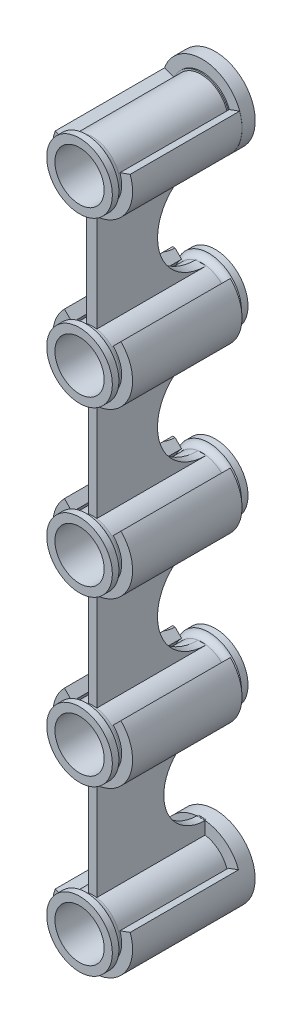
SolidWorks part; units mm, degrees
ref_plane "Front Plane" through (0, 0, 0) normal (0, 0, 1) x (1, 0, 0)
ref_plane "Top Plane" through (0, 0, 0) normal (0, 1, 0) x (1, 0, 0)
ref_plane "Right Plane" through (0, 0, 0) normal (1, 0, 0) x (0, 0, -1)
sketch "Sketch1" plane through (0, 0, 0) normal (0, 0, 1) x (1, 0, 0)
  line L0 (0, 0) -> (0, 4.0671) construction
  line L1 (0, 0) -> (3.5034, 0) construction
  line L2 (0, 0) -> (0, -3.7032) construction
  line L3 (0, 0) -> (-3.861, 0) construction
  line L4 (0, 0) -> (-7.4082, -2.6964) construction
  line L5 (0, 0) -> (7.4082, -2.6964) construction
  line L7 (0.75, 4.4408) -> (-0.75, 4.4408)
  line L8 (0.75, 4.4408) -> (0.75, 23.3282)
  line L9 (0.75, 23.3282) -> (-0.75, 23.3282)
  line L10 (-0.75, 4.4408) -> (-0.75, 23.3282)
  line L11 (0.75, 34.3376) -> (-0.75, 34.3376)
  line L12 (0.75, 34.3376) -> (0.75, 53.6844)
  line L13 (0.75, 53.6844) -> (-0.75, 53.6844)
  line L14 (-0.75, 34.3376) -> (-0.75, 53.6844)
  line L15 (0.75, 64.2553) -> (-0.75, 64.2553)
  line L16 (0.75, 64.2553) -> (0.75, 83.5232)
  line L17 (0.75, 83.5232) -> (-0.75, 83.5232)
  line L18 (-0.75, 64.2553) -> (-0.75, 83.5232)
  line L19 (0.75, 93.8385) -> (-1.171, 93.8385)
  line L20 (0.75, 93.8385) -> (0.75, 113.6965)
  line L21 (0.75, 113.6965) -> (-1.171, 113.6965)
  line L22 (-1.171, 93.8385) -> (-1.171, 113.6965)
  line L31 (0, 0) -> (4.6985, 1.7101)
  line L32 (0, 0) -> (-4.6985, 1.7101)
  line L33 (-4.9804, 1.8127) -> (-6.8598, 2.4967)
  line L34 (4.9804, 1.8127) -> (6.8598, 2.4967)
  line L35 (0, 30) -> (4.6985, 31.7101)
  line L36 (0, 30) -> (-4.6985, 31.7101)
  line L37 (-4.9804, 31.8127) -> (-6.8598, 32.4967)
  line L38 (4.9804, 31.8127) -> (6.8598, 32.4967)
  line L39 (0, 30) -> (3.5034, 30) construction
  line L40 (0, 30) -> (0, 26.2968) construction
  line L41 (0, 30) -> (-3.861, 30) construction
  line L42 (0, 30) -> (-7.4082, 27.3036) construction
  line L43 (0, 30) -> (7.4082, 27.3036) construction
  line L44 (0, 60) -> (4.6985, 61.7101)
  line L45 (0, 60) -> (-4.6985, 61.7101)
  line L46 (-4.9804, 61.8127) -> (-6.8598, 62.4967)
  line L47 (4.9804, 61.8127) -> (6.8598, 62.4967)
  line L48 (0, 60) -> (3.5034, 60) construction
  line L49 (0, 60) -> (0, 56.2968) construction
  line L50 (0, 60) -> (-3.861, 60) construction
  line L51 (0, 60) -> (-7.4082, 57.3036) construction
  line L52 (0, 60) -> (7.4082, 57.3036) construction
  line L53 (0, 90) -> (4.6985, 91.7101)
  line L54 (0, 90) -> (-4.6985, 91.7101)
  line L55 (-4.9804, 91.8127) -> (-6.8598, 92.4967)
  line L56 (4.9804, 91.8127) -> (6.8598, 92.4967)
  line L57 (0, 90) -> (3.5034, 90) construction
  line L58 (0, 90) -> (0, 86.2968) construction
  line L59 (0, 90) -> (-3.861, 90) construction
  line L60 (0, 90) -> (-7.4082, 87.3036) construction
  line L61 (0, 90) -> (7.4082, 87.3036) construction
  line L62 (0, 120) -> (4.6985, 121.7101)
  line L63 (0, 120) -> (-4.6985, 121.7101)
  line L64 (-4.9804, 121.8127) -> (-6.8598, 122.4967)
  line L65 (4.9804, 121.8127) -> (6.8598, 122.4967)
  line L66 (0, 120) -> (3.5034, 120) construction
  line L67 (0, 120) -> (0, 116.2968) construction
  line L68 (0, 120) -> (-3.861, 120) construction
  line L69 (0, 120) -> (-7.4082, 117.3036) construction
  line L70 (0, 120) -> (7.4082, 117.3036) construction
  circle A0 centre (0, 0) radius 5
  arc A1 (-4.9804, 1.8127) -> (4.9804, 1.8127) centre (0, 0) ccw
  arc A2 (-6.8598, 2.4967) -> (6.8598, 2.4967) centre (0, 0) ccw
  circle A18 centre (0, 0) radius 5.3 construction
  circle A19 centre (0, 0) radius 7.3 construction
  circle A20 centre (0, 30) radius 5
  arc A21 (-4.9804, 31.8127) -> (4.9804, 31.8127) centre (0, 30) ccw
  arc A22 (-6.8598, 32.4967) -> (6.8598, 32.4967) centre (0, 30) ccw
  circle A23 centre (0, 60) radius 5
  arc A24 (-4.9804, 61.8127) -> (4.9804, 61.8127) centre (0, 60) ccw
  arc A25 (-6.8598, 62.4967) -> (6.8598, 62.4967) centre (0, 60) ccw
  circle A26 centre (0, 90) radius 5
  arc A27 (-4.9804, 91.8127) -> (4.9804, 91.8127) centre (0, 90) ccw
  arc A28 (-6.8598, 92.4967) -> (6.8598, 92.4967) centre (0, 90) ccw
  circle A29 centre (0, 120) radius 5
  arc A30 (-4.9804, 121.8127) -> (4.9804, 121.8127) centre (0, 120) ccw
  arc A31 (-6.8598, 122.4967) -> (6.8598, 122.4967) centre (0, 120) ccw
  dimension "D1" = 10
  dimension "D3" = 2
  dimension "D6" = 5
  dimension "D4" = 70
  dimension "D5" = 1.5
  dimension "D7" = 0.75
  dimension "D2" = 0.3
extrude "Boss-Extrude1" add sketch "Sketch1" along normal blind 20 contours L33 A2 L34 A1 | L32 A0 L31 | L31 A0 L8 L7 L10 L32 | A22 L10 A0 L8 | L8 A0 L10 L7 | L37 A22 L10 L9 L8 L38 A21 | L10 A22 L8 L9 | L36 A20 L35 | A25 L14 A20 L12 | L35 A20 L12 L11 L14 L36 | L12 A20 L14 L11 | L14 A25 L12 L13 | L46 A25 L14 L13 L12 L47 A24 | L45 A23 L44 | L44 A23 L16 L15 L18 L45 | L16 A23 L18 L15 | A28 L18 A23 L16 | L55 A28 L18 L17 L16 L56 A27 | L18 A28 L16 L17 | L54 A26 L53 | L53 A26 L20 L19 L22 L54 | L20 A26 L22 L19 | A31 L22 A26 L20 | L22 A31 L20 L21 | L64 A31 L22 L21 L20 L65 A30 | L63 A29 L62 | L62 A29 L63
ref_plane "Plane1" through (0, 0, 0) normal (1, 0, 0) x (0, 0, -1)
sketch "Sketch2" plane through (0, 0, 0) normal (1, 0, 0) x (0, 0, -1)
  line L0 (-32.9383, -0.2531) -> (-29, -0.2531)
  line L2 (-20, 29.9717) -> (-34.2799, 29.9717) construction
  line L3 (-20, 34.9434) -> (-20, 25) construction
  line L4 (-29, -4.8283) -> (-31.5, -4.8283)
  line L5 (-31.5, -4.8283) -> (-32.8236, -5.7551)
  line L6 (-33.1383, -5.5912) -> (-33.1383, -0.4531)
  line L9 (-20, 25.1717) -> (-31.5, 25.1717)
  line L10 (-31.5, 25.1717) -> (-33.1383, 24.0246)
  line L11 (-33.1383, 24.0246) -> (-33.1383, 29.9717) construction
  line L12 (-33.1383, 29.9717) -> (-20, 29.9717)
  line L13 (-20, 29.9717) -> (-34.28, 29.9717) construction
  line L14 (-30, 55.1717) -> (-31.5, 55.1717)
  line L15 (-31.5, 55.1717) -> (-33.1383, 54.0246)
  line L16 (-33.1383, 54.0246) -> (-33.1383, 59.9717) construction
  line L17 (-33.1383, 59.9717) -> (-30, 59.9717)
  line L18 (-30, 59.9717) -> (-34.28, 59.9717) construction
  line L19 (-30, 85.1717) -> (-31.5, 85.1717)
  line L20 (-31.5, 85.1717) -> (-33.1383, 84.0246)
  line L21 (-33.1383, 84.0246) -> (-33.1383, 89.9717) construction
  line L22 (-33.1383, 89.9717) -> (-30, 89.9717)
  line L23 (-30, 89.9717) -> (-34.28, 89.9717) construction
  line L24 (-30, 115.1717) -> (-31.5, 115.1717)
  line L25 (-31.5, 115.1717) -> (-33.1383, 114.0246)
  line L26 (-33.1383, 114.0246) -> (-33.1383, 119.9717) construction
  line L27 (-33.1383, 119.9717) -> (-30, 119.9717)
  line L28 (-30, 119.9717) -> (-34.28, 119.9717) construction
  line L29 (-20, 29.9717) -> (-20, 25.1717)
  line L30 (-30, 59.9717) -> (-30, 55.1717)
  line L31 (-30, 89.9717) -> (-30, 85.1717)
  line L32 (-30, 119.9717) -> (-30, 115.1717)
  line L34 (-29, -0.2531) -> (-29, -4.8283)
  line L37 (-34.1383, -0.0283) -> (-34.1383, 0.9717)
  line L39 (-34.1383, 0.9717) -> (-29, 0.9717) construction
  line L40 (-34.1383, -7.8964) -> (-34.1383, 0.9717) construction
  line L41 (-31.1847, -5.8283) -> (-34.1383, -7.8964) construction
  line L42 (-29, -5.8283) -> (-31.1847, -5.8283) construction
  line L43 (-30, -4.8283) -> (-31.5, -4.8283) construction
  line L44 (-33.1383, -0.0283) -> (-30, -0.0283) construction
  line L45 (-30, -0.0283) -> (-30, -4.8283) construction
  line L46 (-29, 0.9717) -> (-29, -5.8283) construction
  line L47 (-33.1383, -5.9754) -> (-33.1383, -0.0283) construction
  line L48 (-31.5, -4.8283) -> (-33.1383, -5.9754) construction
  line L49 (-24.3872, -0.0283) -> (-29, -0.0283) construction
  line L50 (-29, -0.0283) -> (-35.6128, -0.0283) construction
  arc A0 (-33.1383, -5.5912) -> (-32.8236, -5.7551) centre (-32.9383, -5.5912) ccw
  arc A1 (-32.9383, -0.2531) -> (-33.1383, -0.4531) centre (-32.9383, -0.4531) ccw
  point P50 (-33.1383, -5.9754)
  point P54 (-30, -0.0283)
  dimension "D6" = 0.2
  dimension "D1" = 0.2
  dimension "D2" = 4.1383
  dimension "D3" = 145
  dimension "D4" = 2
  dimension "D7" = 1
  dimension "D5" = 5
sketch "Sketch3" plane through (0, 0, 0) normal (1, 0, 0) x (0, 0, -1)
sketch "Sketch4" plane through (0, 0, 20) normal (0, 0, 1) x (1, 0, 0)
  circle A0 centre (0, 0) radius 5
  circle A1 centre (0, 30) radius 5
  circle A2 centre (0, 60) radius 5
  circle A3 centre (0, 90) radius 5
  circle A4 centre (0, 120) radius 5
extrude "Boss-Extrude2" add sketch "Sketch4" along normal blind 1.2
sketch "Sketch5" plane through (0, 0, 21.2) normal (0, 0, 1) x (1, 0, 0)
  line L0 (0, 0) -> (0, 3.1634) construction
  circle A0 centre (0, 0) radius 6
  circle A1 centre (0, 30) radius 6
  circle A2 centre (0, 60) radius 6
  circle A3 centre (0, 90) radius 6
  circle A4 centre (0, 120) radius 6
  dimension "D1" = 12
  dimension "D2" = 5
extrude "Boss-Extrude3" add sketch "Sketch5" along normal blind 1.2
fillet "Fillet1" radius 1.2 1 edges at (5, 0, 21.2)
fillet "Fillet2" radius 1.2 1 edges at (5, 30, 21.2)
fillet "Fillet3" radius 1.2 1 edges at (5, 60, 21.2)
fillet "Fillet4" radius 1.2 1 edges at (5, 90, 21.2)
fillet "Fillet5" radius 1.2 1 edges at (5, 120, 21.2)
sketch "Sketch6" plane through (0, 0, 22.4) normal (0, 0, 1) x (1, 0, 0)
  line L0 (0, 0) -> (0, 2.0017) construction
  circle A0 centre (0, 0) radius 4.5
  circle A1 centre (0, 30) radius 4.5
  circle A2 centre (0, 60) radius 4.5
  circle A3 centre (0, 90) radius 4.5
  circle A4 centre (0, 120) radius 4.5
  dimension "D1" = 9
  dimension "D2" = 5
extrude "Cut-Extrude1" cut sketch "Sketch6" against normal blind 74.2
sketch "Sketch7" plane through (0, 0, 0) normal (0, 0, -1) x (-1, 0, 0)
  line L0 (4.9804, 1.8127) -> (6.8598, 2.4967) construction
  line L1 (-6.8598, 2.4967) -> (-4.9804, 1.8127)
  line L2 (6.8598, 2.4967) -> (4.9804, 1.8127)
  line L3 (0, 0) -> (0, 1.0014) construction
  line L4 (-6.8598, 32.4967) -> (-4.9804, 31.8127)
  line L5 (6.8598, 32.4967) -> (4.9804, 31.8127)
  line L6 (-6.8598, 62.4967) -> (-4.9804, 61.8127)
  line L7 (6.8598, 62.4967) -> (4.9804, 61.8127)
  line L8 (-6.8598, 92.4967) -> (-4.9804, 91.8127)
  line L9 (6.8598, 92.4967) -> (4.9804, 91.8127)
  line L10 (-6.8598, 122.4967) -> (-4.9804, 121.8127)
  line L11 (6.8598, 122.4967) -> (4.9804, 121.8127)
  arc A0 (-6.8598, 2.4967) -> (6.8598, 2.4967) centre (0, 0) ccw
  arc A1 (-4.9804, 1.8127) -> (4.9804, 1.8127) centre (0, 0) ccw
  arc A2 (-4.9804, 1.8127) -> (4.9804, 1.8127) centre (0, 0) ccw construction
  arc A3 (-6.8598, 32.4967) -> (6.8598, 32.4967) centre (0, 30) ccw
  arc A4 (-4.9804, 31.8127) -> (4.9804, 31.8127) centre (0, 30) ccw
  arc A5 (-6.8598, 62.4967) -> (6.8598, 62.4967) centre (0, 60) ccw
  arc A6 (-4.9804, 61.8127) -> (4.9804, 61.8127) centre (0, 60) ccw
  arc A7 (-6.8598, 92.4967) -> (6.8598, 92.4967) centre (0, 90) ccw
  arc A8 (-4.9804, 91.8127) -> (4.9804, 91.8127) centre (0, 90) ccw
  arc A9 (-6.8598, 122.4967) -> (6.8598, 122.4967) centre (0, 120) ccw
  arc A10 (-4.9804, 121.8127) -> (4.9804, 121.8127) centre (0, 120) ccw
  dimension "D1" = 5
sketch "Sketch8" plane through (0, 0, 0) normal (0, 0, -1) x (-1, 0, 0)
  circle A0 centre (0, 120) radius 5.3
  circle A1 centre (0, 0) radius 7.3
extrude "Boss-Extrude4" add sketch "Sketch8" against normal blind 0.2
sketch "Sketch9" plane through (0, 0, 0) normal (0, 0, -1) x (-1, 0, 0)
  line L0 (0, 90) -> (0, 92.1202) construction
  line L1 (0, 90) -> (2.6019, 90) construction
  line L2 (-3.7477, 93.7477) -> (-5.1619, 95.1619)
  line L3 (3.7477, 93.7477) -> (5.1619, 95.1619)
  line L4 (-3.7477, 63.7477) -> (-5.1619, 65.1619)
  line L5 (3.7477, 63.7477) -> (5.1619, 65.1619)
  line L6 (0, 60) -> (2.6019, 60) construction
  line L7 (-3.7477, 33.7477) -> (-5.1619, 35.1619)
  line L8 (3.7477, 33.7477) -> (5.1619, 35.1619)
  line L9 (0, 30) -> (2.6019, 30) construction
  arc A0 (-5.1619, 95.1619) -> (5.1619, 95.1619) centre (0, 90) ccw
  arc A1 (-3.7477, 93.7477) -> (3.7477, 93.7477) centre (0, 90) ccw
  arc A2 (-5.1619, 65.1619) -> (5.1619, 65.1619) centre (0, 60) ccw
  arc A3 (-3.7477, 63.7477) -> (3.7477, 63.7477) centre (0, 60) ccw
  arc A4 (-5.1619, 35.1619) -> (5.1619, 35.1619) centre (0, 30) ccw
  arc A5 (-3.7477, 33.7477) -> (3.7477, 33.7477) centre (0, 30) ccw
  dimension "D1" = 45
  dimension "D2" = 3
extrude "Boss-Extrude5" add sketch "Sketch9" against normal up to surface (20 mm away)
sketch "Sketch10" plane through (0, 0, 0) normal (0, 0, -1) x (-1, 0, 0)
  line L0 (0, 30) -> (0, 32.1681) construction
  line L1 (0, 30) -> (1.362, 30) construction
  line L2 (0, 60) -> (1.362, 60) construction
  line L3 (0, 90) -> (1.362, 90) construction
  circle A0 centre (0, 30) radius 5
  circle A1 centre (0, 30) radius 4.5
  circle A2 centre (0, 60) radius 5
  circle A3 centre (0, 60) radius 4.5
  circle A4 centre (0, 90) radius 5
  circle A5 centre (0, 90) radius 4.5
  dimension "D1" = 0.5
  dimension "D2" = 3
extrude "Boss-Extrude6" add sketch "Sketch10" along normal blind 1.2
sketch "Sketch11" plane through (0, 0, -1.2) normal (0, 0, -1) x (-1, 0, 0)
  circle A0 centre (0, 30) radius 6
  circle A1 centre (0, 30) radius 4.5
  circle A2 centre (0, 60) radius 6
  circle A3 centre (0, 60) radius 4.5
  circle A4 centre (0, 90) radius 4.5
  circle A5 centre (0, 90) radius 6
extrude "Boss-Extrude7" add sketch "Sketch11" along normal blind 1.2
fillet "Fillet6" radius 1.2 1 edges at (-5, 90, -1.2)
fillet "Fillet7" radius 1.2 1 edges at (-5, 60, -1.2)
fillet "Fillet8" radius 1.2 1 edges at (-5, 30, -1.2)
sketch "Sketch12" plane through (0, 0, 0) normal (0, 0, -1) x (-1, 0, 0)
  circle A0 centre (0, 0) radius 7.3
  circle A1 centre (0, 120) radius 7.317
extrude "Boss-Extrude8" add sketch "Sketch12" along normal up to surface (2.4 mm away)
sketch "Sketch13" plane through (0.75, 0, 0) normal (1, 0, 0) x (0, 0, -1)
  line L0 (0, 22.7386) -> (0, 4.9434)
  line L1 (-0.2605, 4.9434) -> (0, 4.9434)
  line L2 (-20, 4.9434) -> (-0.2, 4.9434) construction
  line L3 (0, 7.2359) -> (0, 22.7386)
  line L4 (0, 34.9434) -> (0, 52.7386)
  line L5 (0, 64.9434) -> (0, 82.7386)
  line L6 (0, 94.9434) -> (0, 112.7215)
  arc A0 (0, 7.2359) -> (0, 22.7386) centre (0, 14.9873) cw
  arc A1 (0, 34.9434) -> (0, 52.7386) centre (0, 43.841) cw
  arc A2 (0, 64.9434) -> (0, 82.7386) centre (0, 73.841) cw
  arc A3 (0, 94.9434) -> (0, 112.7215) centre (0, 103.8325) cw
extrude "Cut-Extrude4" cut sketch "Sketch13" against normal blind 22.2 contours A1 L4 | A0 L0 L1 L2 | A2 L5 | A3 L6
